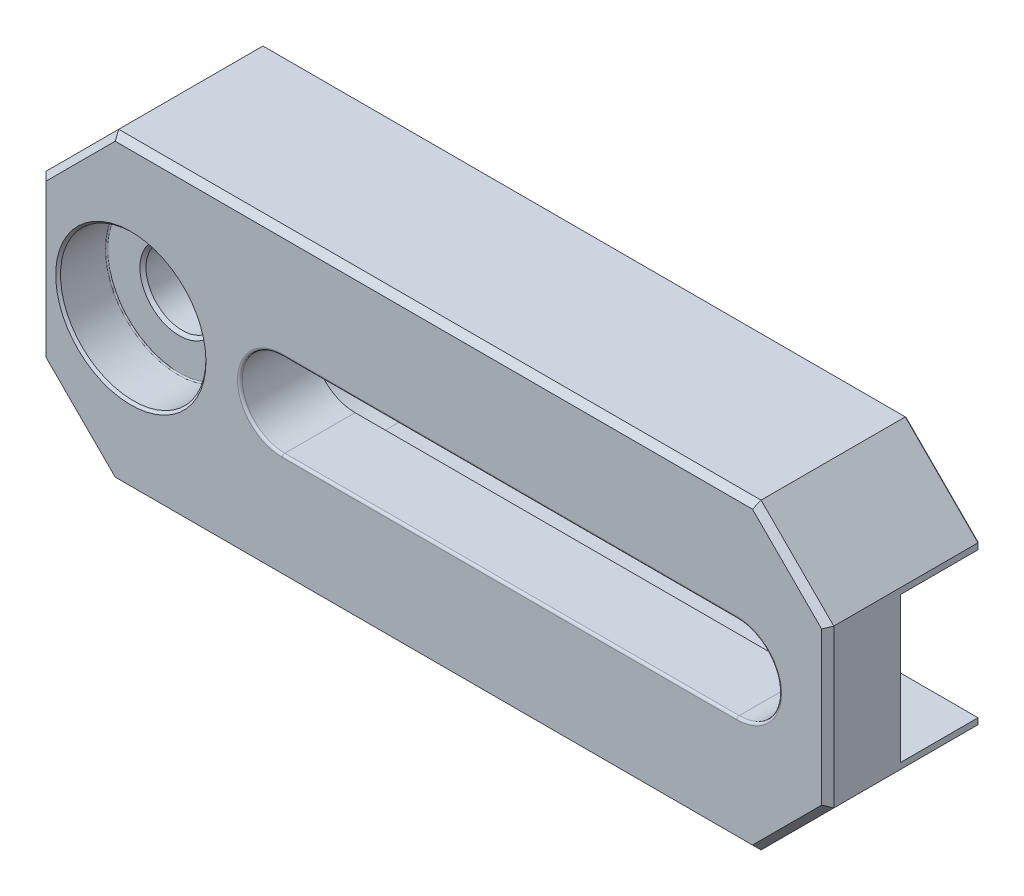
SolidWorks part; units mm, degrees
ref_plane "Plan1" through (0, 0, 0) normal (0, 0, 1) x (1, 0, 0)
ref_plane "Plan2" through (0, 0, 0) normal (0, 1, 0) x (1, 0, 0)
ref_plane "Plan3" through (0, 0, 0) normal (1, 0, 0) x (0, 0, -1)
ref_plane "Plan4" through (0, 0, 0) normal (0, 0, -1) x (-1, 0, 0)
sketch "Esquisse1" plane through (0, 0, 0) normal (0, 0, -1) x (-1, 0, 0)
  line L0 (0, 12.5) -> (-65, 12.5)
  line L1 (-65, 12.5) -> (-65, -12.5)
  line L2 (-65, -12.5) -> (0, -12.5)
  line L3 (0, -12.5) -> (0, 12.5)
  dimension "D1" = 25
  dimension "D2" = 65
extrude "Base-Extrusion" add sketch "Esquisse1" against normal blind 12.5
hole_wizard "Perçage1" positions "Esquisse3" profile "Esquisse2" legacy
sketch "Esquisse3" plane through (0, 0, 12.5) normal (0, 0, 1) x (1, 0, 0)
  line L0 (0, 0) -> (65, 0) construction
  line L1 (65, 12.5) -> (65, -12.5) construction
  point P0 (7.5, 0)
  dimension "D2" = 7.5
sketch "Esquisse2" plane through (7.5, 0, 12.5) normal (1, 0, 0) x (0, -1, 0)
  line L0 (0, 0) -> (0, 12.5)
  line L1 (0, 12.5) -> (3, 12.5)
  line L2 (3, 12.5) -> (3, 4)
  line L3 (3, 4) -> (6, 4)
  line L4 (6, 4) -> (6, 0)
  line L5 (6, 0) -> (0, 0)
  line L6 (0, 110) -> (0, -10) construction
  dimension "Diameter" = 6
  dimension "Depth" = 12.5
  dimension "C.Bore Ø" = 12
  dimension "Bore Depth" = 4
sketch "Esquisse4" plane through (0, 0, 0) normal (0, 0, -1) x (-1, 0, 0)
  line L0 (-70, -6) -> (-20, -6)
  line L1 (-20, 6) -> (-70, 6)
  line L2 (-70, 6) -> (-70, -6)
  line L3 (0, 0) -> (-67.4325, 0) construction
  arc A0 (-20, -6) -> (-20, 6) centre (-20, 0) ccw
  dimension "D2" = 12
  dimension "D3" = 50
  dimension "D4" = 20
extrude "Enlèv. mat.-Extru.1" cut sketch "Esquisse4" against normal blind 6.5
sketch "Esquisse5" plane through (0, 0, 12.5) normal (0, 0, 1) x (1, 0, 0)
  line L0 (57.5, 3.5) -> (20, 3.5)
  line L1 (20, -3.5) -> (57.5, -3.5)
  line L2 (0, 0) -> (65, 0) construction
  line L3 (65, 12.5) -> (65, -12.5) construction
  arc A0 (20, 3.5) -> (20, -3.5) centre (20, 0) ccw
  arc A1 (57.5, -3.5) -> (57.5, 3.5) centre (57.5, 0) ccw
  dimension "D1" = 20
  dimension "D2" = 37.5
  dimension "D3" = 7
extrude "Enlèv. mat.-Extru.2" cut sketch "Esquisse5" against normal up to next
chamfer "Chanfrein5" distance 6 angle 45 4 edges at (0, -12.5, 6.25) (65, -12.5, 6.25) (65, 12.5, 6.25) (0, 12.5, 6.25)
chamfer "Chanfrein6" distance 0.5 angle 45 8 edges at (0, 0, 12.5) (32.5, 12.5, 12.5) (32.5, -12.5, 12.5) (65, 0, 12.5) (62, 9.5, 12.5) (62, -9.5, 12.5) (3, -9.5, 12.5) (3, 9.5, 12.5)
fillet "Congé1" radius 0.2 4 edges at (61, 0, 12.5) (38.75, -3.5, 12.5) (16.5, 0, 12.5) (38.75, 3.5, 12.5)
chamfer "Chanfrein7" distance 0.2 angle 45 1 edges at (13.5, 0, 12.5)
fillet "Congé2" radius 0.1 1 edges at (13.5, 0, 8.5)
chamfer "Chanfrein8" distance 0.25 angle 45 1 edges at (10.5, 0, 8.5)
chamfer "Chanfrein9" distance 0.1 angle 45 12 edges at (3, -9.5, 0) (32.5, -12.5, 0) (62, -9.5, 0) (65, -6.25, 0) (42.5, -6, 0) (14, 0, 0) (42.5, 6, 0) (65, 6.25, 0) (62, 9.5, 0) (3, 9.5, 0) (0, 0, 0) (32.5, 12.5, 0)
